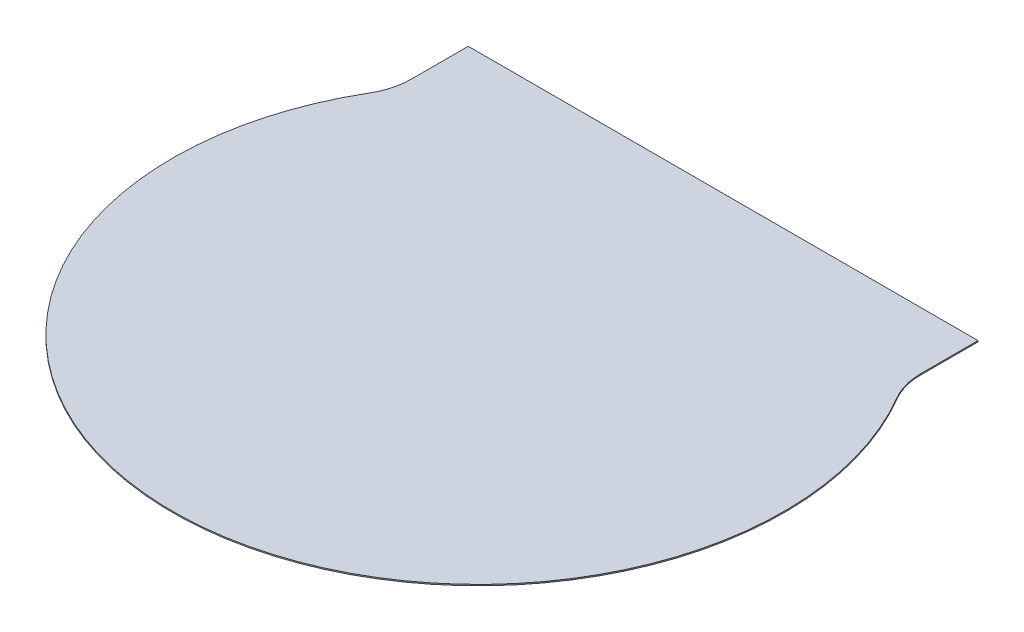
SolidWorks part; units mm, degrees
ref_plane "Front Plane" through (0, 0, 0) normal (0, 0, 1) x (1, 0, 0)
ref_plane "Top Plane" through (0, 0, 0) normal (0, 1, 0) x (1, 0, 0)
ref_plane "Right Plane" through (0, 0, 0) normal (1, 0, 0) x (0, 0, -1)
sketch "Sketch1" plane through (0, 0, 0) normal (0, 1, 0) x (1, 0, 0)
  line L0 (3.175, 3.048) -> (-3.175, 3.048)
  line L1 (-3.175, 2.3383) -> (-3.175, 3.048)
  line L2 (3.175, 2.3383) -> (3.175, 3.048)
  arc A0 (-3.2866, 1.9272) -> (3.2866, 1.9272) centre (0, 0) ccw
  arc A1 (-3.2866, 1.9272) -> (-3.175, 2.3383) centre (-3.9878, 2.3383) ccw
  arc A2 (-3.2866, 1.9272) -> (-3.175, 2.3383) centre (-3.9878, 2.3383) ccw
  arc A3 (3.175, 2.3383) -> (3.2866, 1.9272) centre (3.9878, 2.3383) ccw
extrude "Extrude1" add sketch "Sketch1" along normal blind 0.015 contours A3 L2 L0 L1 A1 A0
